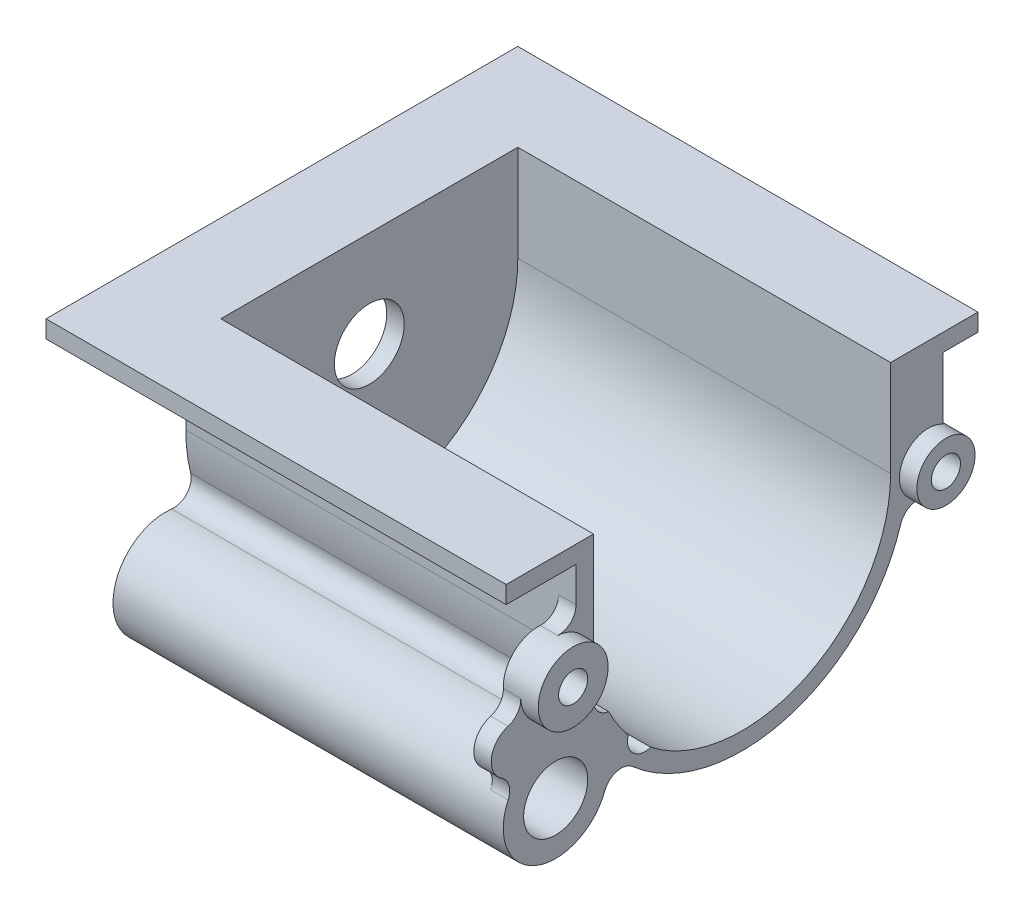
SolidWorks part; units mm, degrees
ref_plane "Front Plane" through (0, 0, 0) normal (0, 0, 1) x (1, 0, 0)
ref_plane "Top Plane" through (0, 0, 0) normal (0, 1, 0) x (1, 0, 0)
ref_plane "Right Plane" through (0, 0, 0) normal (1, 0, 0) x (0, 0, -1)
sketch "Sketch1" plane through (0, 0, 0) normal (1, 0, 0) x (0, 0, -1)
  line L0 (28.5, 0) -> (28.5, 16.5)
  line L1 (-28.5, 16.5) -> (28.5, 16.5)
  line L2 (-28.5, 0) -> (-28.5, 16.5)
  arc A0 (28.5, 0) -> (-28.5, 0) centre (0, 0) cw
  dimension "D1" = 45
  dimension "D2" = 28.5
extrude "Extrude1" add sketch "Sketch1" along normal blind 67
shell "Shell1" thickness 3
sketch "Sketch2" plane through (0, 16.5, 0) normal (0, 1, 0) x (-1, 0, 0)
  line L3 (-67, -25.5) -> (-67, -40.5)
  line L4 (-67, 25.5) -> (-67, 40.5)
  line L5 (-67, -28.5) -> (-67, -25.5) construction
  line L9 (12, 40.5) -> (-67, 40.5)
  line L10 (12, -40.5) -> (12, 40.5)
  line L11 (-67, -40.5) -> (12, -40.5)
  line L13 (0, -28.5) -> (0, 28.5)
  line L14 (0, 28.5) -> (-67, 28.5)
  line L15 (-67, 28.5) -> (-67, 25.5)
  line L16 (-67, -28.5) -> (0, -28.5)
  line L26 (-67, 25.5) -> (-3, 25.5)
  line L27 (-67, 25.5) -> (-3, 25.5)
  line L28 (-3, 25.5) -> (-3, -25.5)
  line L29 (-3, 25.5) -> (-3, -25.5)
  line L30 (-3, -25.5) -> (-67, -25.5)
  line L31 (-3, -25.5) -> (-67, -25.5)
  line L32 (-67, -25.5) -> (-67, -28.5)
  dimension "D1" = 15
  dimension "D3" = 15
  dimension "D4" = 15
  dimension "D2" = 0
extrude "Extrude2" add sketch "Sketch2" against normal blind 3
sketch "Sketch3" plane through (67, 0, 0) normal (1, 0, 0) x (0, 0, -1)
  line L0 (-25.5, 16.5) -> (-40.5, 16.5) construction
  line L1 (-28.5, 13.5) -> (-28.5, 0) construction
  line L2 (-28.5, 3.3734) -> (-28.5, 0)
  arc A0 (-28.5, 3.3734) -> (-37.9953, -1.7372) centre (-32, -1.5) ccw
  arc A1 (-40.1628, -15.7094) -> (-24.0176, -15.3429) centre (-32, -19.5) ccw
  arc A2 (-40.164, -4.7391) -> (-41.2445, -11.9334) centre (-39.0588, -8.5833) ccw
  arc A3 (-40.164, -4.7391) -> (-37.9953, -1.7372) centre (-40.993, -1.8559) ccw
  arc A4 (-28.5, 0) -> (28.5, 0) centre (0, 0) ccw construction
  arc A5 (-28.5, 0) -> (-24.0176, -15.3429) centre (0, 0) ccw
  arc A6 (-40.1628, -15.7094) -> (-41.2445, -11.9334) centre (-42.8837, -14.4459) ccw
  dimension "D2" = 18
  dimension "D3" = 18
  dimension "D4" = 12
  dimension "D5" = 32
  dimension "D6" = 8
  dimension "D7" = 3
  dimension "D1" = 36
extrude "Extrude3" add sketch "Sketch3" against normal blind 3
sketch "Sketch4" plane through (67, 0, 0) normal (1, 0, 0) x (0, 0, -1)
  line L1 (34.5, 2.8301) -> (34.5, 13.5)
  line L2 (28.5, 13.5) -> (40.5, 13.5) construction
  line L3 (34.5, 13.5) -> (28.5, 13.5)
  line L5 (40.5, 13.5) -> (40.5, 16.5) construction
  line L6 (28.5, 0) -> (28.5, 13.5) construction
  line L7 (28.5, 0) -> (28.5, 13.5)
  arc A0 (28.1179, -4.6511) -> (34.5, 2.8301) centre (32, -1.5) ccw
  arc A2 (-24.0176, -15.3429) -> (28.5, 0) centre (0, 0) ccw construction
  arc A3 (28.1179, -4.6511) -> (28.5, 0) centre (0, 0) ccw
  dimension "D2" = 10
  dimension "D1" = 32
  dimension "D3" = 6
extrude "Extrude4" add sketch "Sketch4" against normal up to surface (3 mm away)
fillet "Fillet1" radius 3 3 edges at (65.5, 3.3734, 28.5) (65.5, -15.3429, 24.0176) (65.5, -4.6511, -28.1179)
sketch "Sketch5" plane through (67, 0, 0) normal (1, 0, 0) x (0, 0, -1)
  circle A0 centre (32, -1.5) radius 5
  circle A1 centre (-32, -1.5) radius 6
  arc A2 (-31.6667, 4.4907) -> (-37.9953, -1.7372) centre (-32, -1.5) ccw construction
  arc A3 (30.8153, -6.3576) -> (34.5, 2.8301) centre (32, -1.5) ccw construction
extrude "Extrude5" add sketch "Sketch5" along normal blind 3
sketch "Sketch6" plane through (64, 0, 0) normal (-1, 0, 0) x (0, 0, 1)
  arc A0 (23.5676, -22.6455) -> (18.7799, -21.4374) centre (20.7568, -23.694) ccw construction
  arc A1 (23.5676, -22.6455) -> (40.1628, -15.7094) centre (32, -19.5) ccw construction
  arc A2 (23.5676, -22.6455) -> (18.7799, -21.4374) centre (20.7568, -23.694) ccw
  arc A3 (23.5676, -22.6455) -> (30.9298, -10.5639) centre (32, -19.5) ccw
  arc A4 (18.7799, -21.4374) -> (28.5, 0) centre (0, 0) ccw construction
  arc A5 (18.7799, -21.4374) -> (27.6614, -6.8627) centre (0, 0) ccw
  arc A6 (30.9298, -10.5639) -> (27.6614, -6.8627) centre (30.5731, -7.5851) cw
extrude "Extrude6" add sketch "Sketch6" along normal up to surface (64 mm away)
sketch "Sketch7" plane through (67, 0, 0) normal (1, 0, 0) x (0, 0, -1)
  line L0 (-22.5526, -8.2085) -> (0, 0) construction
  line L1 (0, 0) -> (-16.6718, -17.2642) construction
  line L2 (0, 0) -> (-41.5049, 0) construction
  circle A0 centre (-22.5526, -8.2085) radius 3
  circle A2 centre (-16.6718, -17.2642) radius 3
  circle A3 centre (0, 0) radius 24 construction
  dimension "D3" = 48
  dimension "D4" = 6
  dimension "D1" = 20
  dimension "D2" = 46
extrude "Cut-Extrude1" cut sketch "Sketch7" against normal up to surface (64 mm away)
hole_wizard "M5.0 (5) Diameter Hole1" positions "Sketch9" profile "Sketch8" hole size "M5.0" standard "Ansi Metric"
sketch "Sketch9" plane through (70, 0, 0) normal (1, 0, 0) x (0, 0, -1)
  point P0 (-32, -1.5)
  point P1 (32, -1.5)
sketch "Sketch8" plane through (70, -1.5, 32) normal (0, 1, 0) x (0, 0, -1)
  line L0 (0, 0) -> (0, 82)
  line L1 (0, 82) -> (2.5, 82)
  line L2 (2.5, 82) -> (2.5, 0)
  line L5 (2.5, 0) -> (0, 0)
  line L11 (0, -6.35) -> (0, 107.95) construction
  dimension "Thru Hole Dia." = 5
  dimension "Thru Hole Depth" = 82
hole_wizard "M11.0 (11) Diameter Hole1" positions "Sketch11" profile "Sketch10" hole size "M11.0" standard "Ansi Metric"
sketch "Sketch11" plane through (67, 0, 0) normal (1, 0, 0) x (0, 0, -1)
  point P0 (-32, -19.5)
sketch "Sketch10" plane through (67, -19.5, 32) normal (0, 1, 0) x (0, 0, -1)
  line L0 (0, 0) -> (0, 79)
  line L1 (0, 79) -> (5.5, 79)
  line L2 (5.5, 79) -> (5.5, 0)
  line L5 (5.5, 0) -> (0, 0)
  line L11 (0, -6.35) -> (0, 107.95) construction
  dimension "Thru Hole Dia." = 11
  dimension "Thru Hole Depth" = 79
hole_wizard "M12.0 (12) Diameter Hole1" positions "Sketch14" profile "Sketch13" hole size "M12.0" standard "Ansi Metric"
sketch "Sketch14" plane through (3, 0, 0) normal (1, 0, 0) x (0, 0, -1)
  point P0 (0, 0)
sketch "Sketch13" plane through (3, 0, 0) normal (0, 1, 0) x (0, 0, -1)
  line L0 (0, 0) -> (0, 15)
  line L1 (0, 15) -> (6, 15)
  line L2 (6, 15) -> (6, 0)
  line L5 (6, 0) -> (0, 0)
  line L11 (0, -6.35) -> (0, 107.95) construction
  dimension "Thru Hole Dia." = 12
  dimension "Thru Hole Depth" = 15
